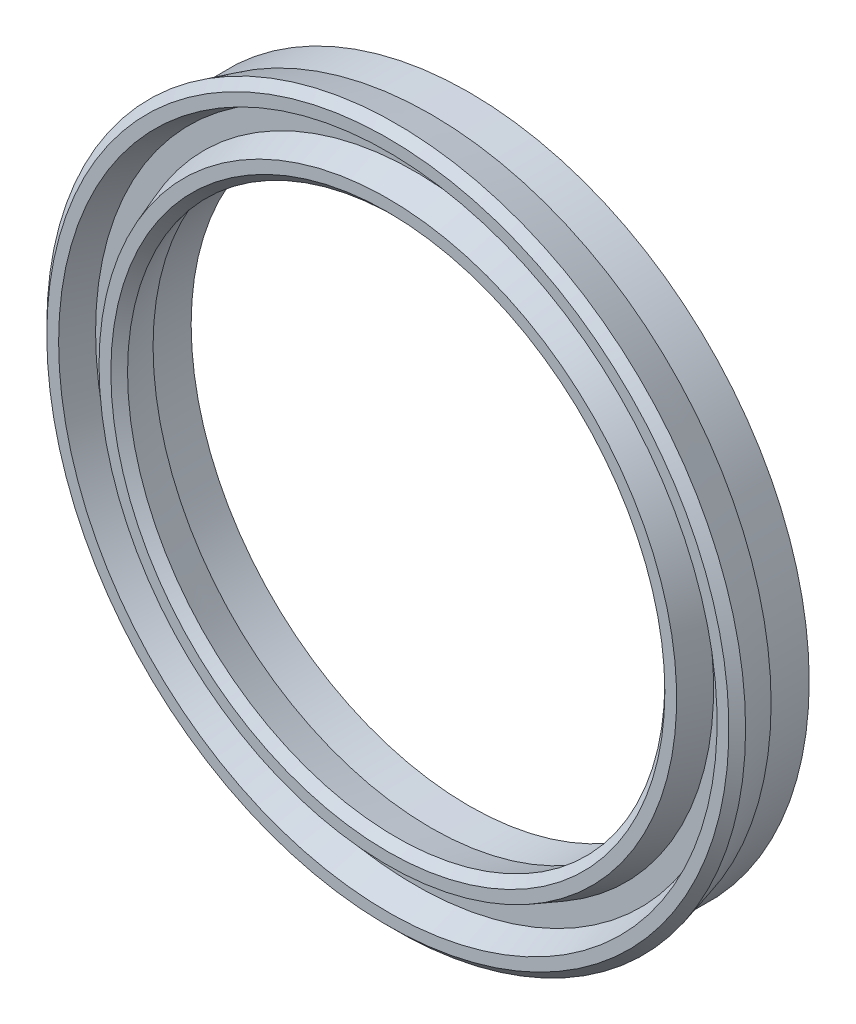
SolidWorks part; units mm, degrees
ref_plane "Front" through (0, 0, 0) normal (0, 0, 1) x (1, 0, 0)
ref_plane "Top" through (0, 0, 0) normal (0, 1, 0) x (1, 0, 0)
ref_plane "Right" through (0, 0, 0) normal (1, 0, 0) x (0, 0, -1)
sketch "Sketch1" plane through (-63.6, 0, -73.5571) normal (0, 1, 0) x (-1, 0, 0)
  line L0 (-63.6, 58.7571) -> (-63.6, 132.3142) construction
  line L1 (-114.2, 58.7571) -> (-125.5, 58.7571)
  line L2 (-125.5, 58.7571) -> (-125.5, 65.692)
  line L3 (-125.5, 65.692) -> (-127.2, 72.0365)
  line L4 (-127.2, 72.0365) -> (-125.6794, 73.5571)
  line L5 (-125.6794, 73.5571) -> (-123.5289, 73.5571)
  line L6 (-123.5289, 73.5571) -> (-121.7333, 68.6238)
  line L7 (-121.7333, 68.6238) -> (-117.9667, 68.6238)
  line L8 (-119.85, 68.6238) -> (-119.85, 58.7571) construction
  line L9 (-116.1711, 73.5571) -> (-117.9667, 68.6238)
  line L10 (-114.0206, 73.5571) -> (-116.1711, 73.5571)
  line L11 (-112.5, 72.0365) -> (-114.0206, 73.5571)
  line L12 (-114.2, 65.692) -> (-112.5, 72.0365)
  line L13 (-114.2, 58.7571) -> (-114.2, 65.692)
  dimension "D" = 123.8
  dimension "h" = 14.8
  dimension "D5" = 45
  dimension "D6" = 120
  dimension "D7" = 9.8667
  dimension "s1" = 11.3
  dimension "D8" = 3.7667
  dimension "s" = 14.7
  dimension "D9" = 70
revolve "Body" add sketch "Sketch1" angle 360 about L0
equation "\"D7@Sketch1\" = \"h@Sketch1\" * 2 / 3"
equation "\"D8@Sketch1\" = \"s1@Sketch1\" / 3"
